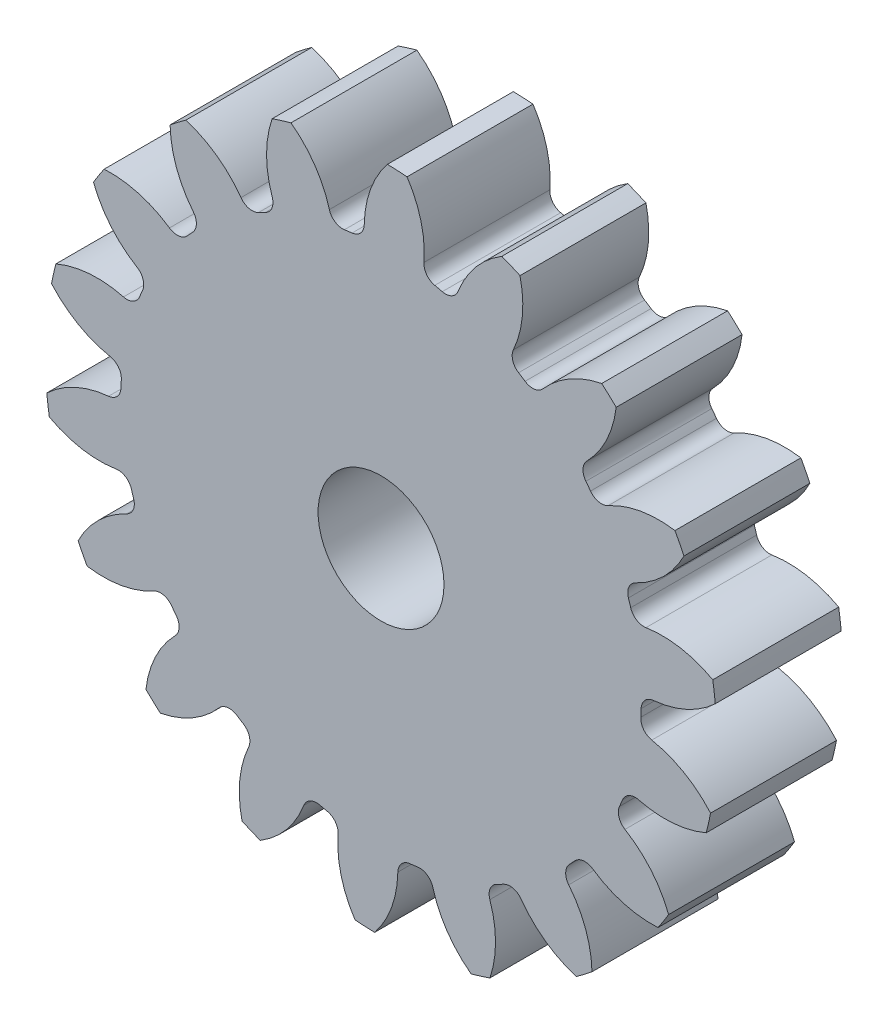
SolidWorks part; units mm, degrees
ref_plane "Front" through (0, 0, 0) normal (0, 0, 1) x (1, 0, 0)
ref_plane "Top" through (0, 0, 0) normal (0, 1, 0) x (1, 0, 0)
ref_plane "Right" through (0, 0, 0) normal (1, 0, 0) x (0, 0, -1)
sketch "Sketch3" plane through (0, 0, 0) normal (0, 0, 1) x (1, 0, 0)
  circle A0 centre (0, 0) radius 338.6667
  dimension "od" = 677.3333
extrude "gearBody" add sketch "Sketch3" along normal blind 127
sketch "Sketch2" plane through (0, 0, 0) normal (0, 0, 1) x (1, 0, 0)
  line L0 (0, 0) -> (264.616, 109.6075) construction
  line L1 (333.7872, -66.7719) -> (0, 0) construction
  line L2 (0, 0) -> (36.3143, 0) construction
  line L3 (304.5696, 11.8494) -> (302.0122, -41.1298) construction
  line L5 (303.2909, -14.6402) -> (0, 0) construction
  line L7 (0, 0) -> (286.4183, 0) construction
  arc A0 (286.3499, 6.2606) -> (284.4155, -33.8121) centre (0, 0) ccw construction
  arc A1 (337.0765, 32.7803) -> (332.352, -65.0944) centre (0, 0) ccw construction
  arc A2 (304.5696, 11.8494) -> (302.0122, -41.1298) centre (0, 0) ccw construction
  arc A3 (261.9452, -16.537) -> (262.3201, -8.7699) centre (0, 0) ccw
  arc A4 (333.7872, -66.7719) -> (273.0608, -30.9338) centre (252.8286, -134.5852) ccw
  arc A5 (333.7872, -66.7719) -> (338.6667, 34.3118) centre (0, 0) ccw
  arc A6 (338.6667, 34.3118) -> (274.7708, 4.4894) centre (264.616, 109.6075) cw
  arc A7 (262.3201, -8.7699) -> (274.7708, 4.4894) centre (276.0961, -9.2305) cw
  arc A8 (273.0608, -30.9338) -> (261.9452, -16.537) centre (275.7015, -17.4054) cw
  point P6 (338.6667, 34.3118)
  point P22 (333.7872, -66.7719)
  dimension "baseDia" = 572.8366
  dimension "od" = 677.3333
  dimension "pd" = 609.6
  dimension "rd" = 524.9333
  dimension "rFillet" = 13.7837
  dimension "pointX" = 338.6667
  dimension "pointY" = 34.3118
  dimension "CTT" = 52.9791
  dimension "flankCenterAngle" = 22.5
extrude "toothCut" cut sketch "Sketch2" along normal through all
pattern_circular "CirPattern1" count 18 over 360 about axis through (0, 0, 0) along (0, 0, 1) of "toothCut"
sketch "hub1Dia" plane through (0, 0, 0) normal (0, 0, -1) x (-1, 0, 0)
  circle A0 centre (0, 0) radius 12.7
  dimension "hub1Dia" = 25.4
sketch "hub2Dia" plane through (0, 0, 127) normal (0, 0, 1) x (1, 0, 0)
  circle A0 centre (0, 0) radius 12.7
  dimension "hub2dia" = 25.4
sketch "boreDia" plane through (0, 0, 0) normal (0, 0, 1) x (1, 0, 0)
  circle A0 centre (0, 0) radius 63.5
  dimension "boreDia" = 127
extrude "bore" cut sketch "boreDia" against normal mid plane 25400
